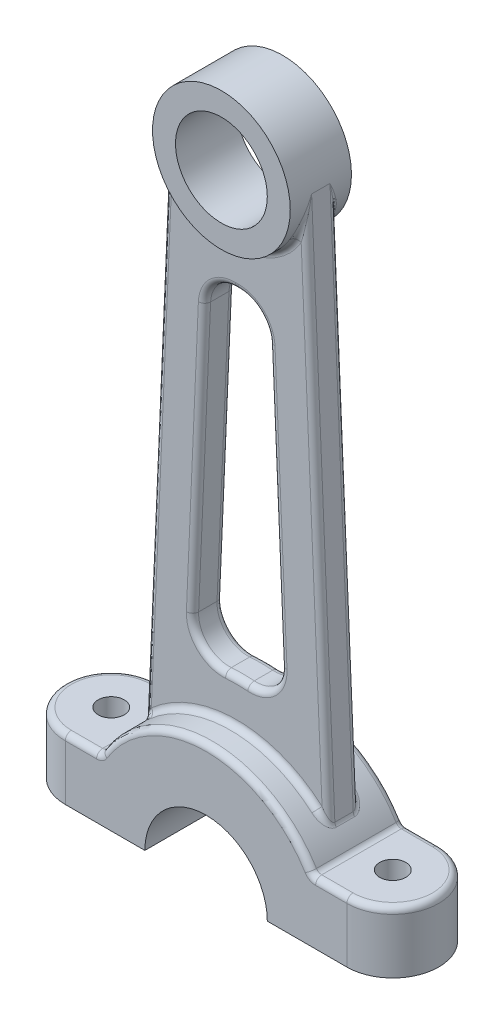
SolidWorks part; units mm, degrees
ref_plane "Front" through (0, 0, 0) normal (0, 0, 1) x (1, 0, 0)
ref_plane "Top" through (0, 0, 0) normal (0, 1, 0) x (1, 0, 0)
ref_plane "Right" through (0, 0, 0) normal (1, 0, 0) x (0, 0, -1)
sketch "Sketch1" plane through (0, 0, 0) normal (0, 0, 1) x (1, 0, 0)
  line L0 (-25.4, 0) -> (-12.7, 0)
  line L1 (12.7, 0) -> (25.4, 0)
  arc A0 (12.7, 0) -> (-12.7, 0) centre (0, 0) ccw
  arc A1 (25.4, 0) -> (-25.4, 0) centre (0, 0) ccw
  dimension "D1" = 50.8
  dimension "D2" = 12.7
extrude "Boss-Extrude1" add sketch "Sketch1" along normal mid plane 19.05
sketch "Sketch2" plane through (0, 0, 0) normal (0, -1, 0) x (1, 0, 0)
  line L0 (12.7, -9.525) -> (29.21, -9.525)
  line L1 (29.21, 9.525) -> (12.7, 9.525)
  line L2 (12.7, 9.525) -> (12.7, -9.525)
  line L3 (0, 0) -> (0, 15.1764) construction
  line L4 (-12.7, 9.525) -> (-12.7, -9.525)
  line L5 (-29.21, 9.525) -> (-12.7, 9.525)
  line L6 (-12.7, -9.525) -> (-29.21, -9.525)
  arc A0 (29.21, -9.525) -> (29.21, 9.525) centre (29.21, 0) ccw
  arc A1 (-29.21, -9.525) -> (-29.21, 9.525) centre (-29.21, 0) cw
  dimension "D1" = 58.42
extrude "Boss-Extrude2" add sketch "Sketch2" against normal blind 12.7
sketch "Sketch3" plane through (0, 0, 0) normal (0, 0, 1) x (1, 0, 0)
  line L0 (14.2739, 127.6232) -> (19.1158, 16.7256)
  line L1 (-14.2739, 127.6232) -> (-19.1158, 16.7256)
  line L2 (0, 0) -> (0, 94.3022) construction
  arc A0 (14.2739, 127.6232) -> (-14.2739, 127.6232) centre (0, 127) ccw
  arc A1 (21.997, 12.7) -> (-21.997, 12.7) centre (0, 0) ccw construction
  arc A2 (19.1158, 16.7256) -> (-19.1158, 16.7256) centre (0, 0) ccw
  dimension "D2" = 28.575
  dimension "D1" = 127
  dimension "D3" = 5
extrude "Boss-Extrude3" add sketch "Sketch3" along normal mid plane 6.35
sketch "Sketch4" plane through (0, 0, 0) normal (0, 0, 1) x (1, 0, 0)
  circle A0 centre (0, 127) radius 14.2875
  arc A3 (14.2739, 127.6232) -> (-14.2739, 127.6232) centre (0, 127) ccw construction
extrude "Boss-Extrude4" add sketch "Sketch4" along normal mid plane 12.7
sketch "Sketch5" plane through (0, 0, 3.175) normal (0, 0, 1) x (1, 0, 0)
  line L17 (-6.3756, 104.7166) -> (-9.5092, 32.9451)
  line L18 (9.5092, 32.9451) -> (6.3756, 104.7166)
  line L19 (-6.3756, 104.7166) -> (-9.5092, 32.9451)
  line L20 (9.5092, 32.9451) -> (6.3756, 104.7166)
  arc A11 (-6.3756, 104.7166) -> (6.3756, 104.7166) centre (0, 127) ccw
  arc A12 (9.5092, 32.9451) -> (-9.5092, 32.9451) centre (0, 0) ccw
  arc A13 (-6.3756, 104.7166) -> (6.3756, 104.7166) centre (0, 127) ccw
  arc A14 (9.5092, 32.9451) -> (-9.5092, 32.9451) centre (0, 0) ccw
  dimension "D1" = 8.89
extrude "Cut-Extrude1" cut sketch "Sketch5" against normal through all
sketch "Sketch6" plane through (0, 0, 6.35) normal (0, 0, 1) x (1, 0, 0)
  circle A0 centre (0, 127) radius 9.525
  dimension "D1" = 19.05
extrude "Cut-Extrude2" cut sketch "Sketch6" against normal through all
fillet "Fillet1" radius 6.35 4 edges at (-9.5092, 32.9451, 0) (9.5092, 32.9451, 0) (6.3756, 104.7166, 0) (-6.3756, 104.7166, 0)
hole_wizard "1/4-28 Tapped Hole1" positions "Sketch8" profile "Sketch7" tap size "1/4-28" standard "ANSI Inch"
sketch "Sketch8" plane through (0, 12.7, 0) normal (0, 1, 0) x (1, 0, 0)
  point P0 (-29.21, 0)
  point P3 (29.21, 0)
sketch "Sketch7" plane through (-29.21, 12.7, 0) normal (1, 0, 0) x (0, 0, 1)
  line L0 (0, 0) -> (0, 12.7)
  line L1 (0, 12.7) -> (2.7051, 12.7)
  line L2 (2.7051, 12.7) -> (2.7051, 0)
  line L5 (2.7051, 0) -> (0, 0)
  line L11 (0, -6.35) -> (0, 107.95) construction
  dimension "Thru Tap Drill Dia." = 5.4102
  dimension "Thru Tap Drill Depth" = 12.7
fillet "Fillet2" radius 1.27 36 edges at (38.735, 12.7, 0) (-38.735, 12.7, 0) (25.6035, 12.7, -9.525) (25.6035, 12.7, 9.525) (-25.6035, 12.7, 9.525) (-25.6035, 12.7, -9.525) (21.997, 12.7, 0) (0, 25.4, 9.525) (-21.997, 12.7, 0) (0, 25.4, -9.525) (-19.1158, 16.7256, 0) (19.1158, 16.7256, 0) (-16.6948, 72.1744, -3.175) (0, 25.4, -3.175) (16.6948, 72.1744, -3.175) (0, 112.7125, -3.175) (-7.2532, 35.9942, -3.175) (-7.9225, 69.2852, -3.175) (-4.7007, 102.0863, -3.175) (0, 103.8225, -3.175) (4.7007, 102.0863, -3.175) (7.9225, 69.2852, -3.175) (7.2532, 35.9942, -3.175) (0, 34.29, -3.175) (0, 25.4, 3.175) (-16.6948, 72.1744, 3.175) (0, 112.7125, 3.175) (16.6948, 72.1744, 3.175) (-4.7007, 102.0863, 3.175) (-7.9225, 69.2852, 3.175) (-7.2532, 35.9942, 3.175) (0, 34.29, 3.175) (7.2532, 35.9942, 3.175) (7.9225, 69.2852, 3.175) (4.7007, 102.0863, 3.175) (0, 103.8225, 3.175)
